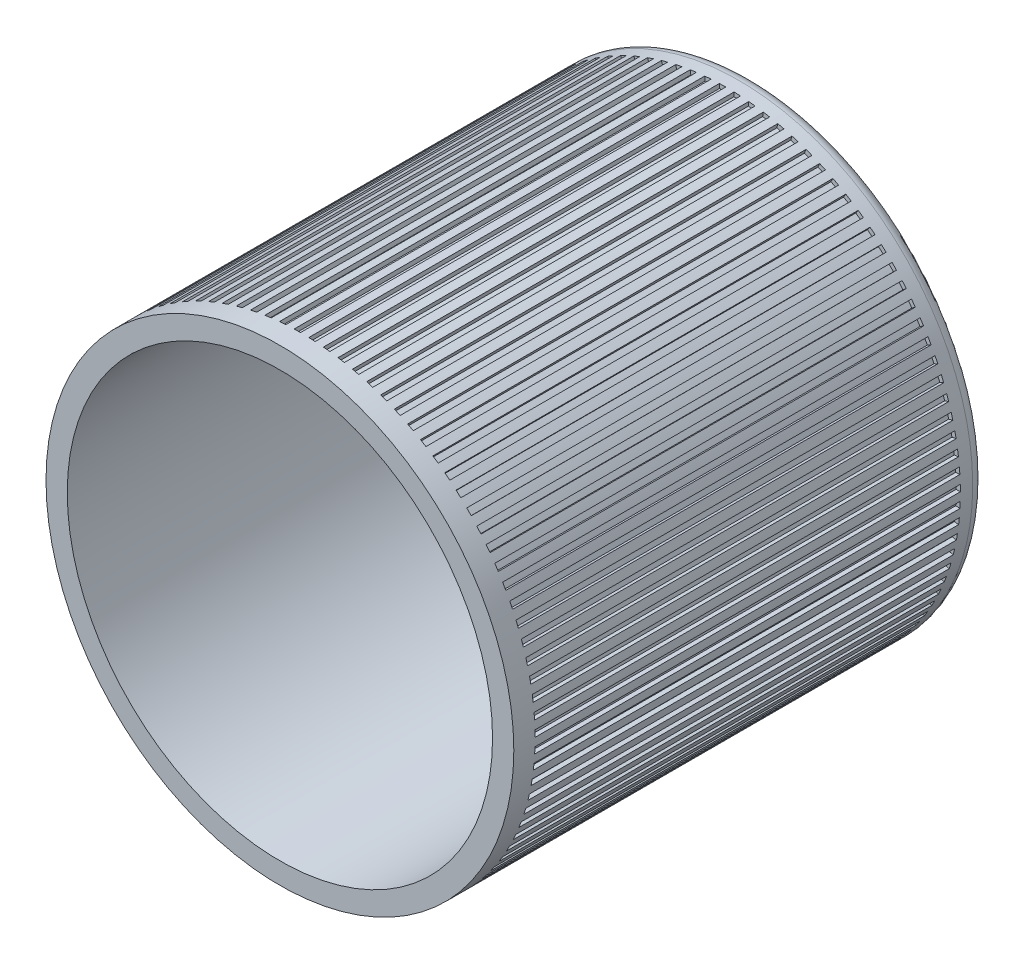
SolidWorks part; units mm, degrees
ref_plane "Front Plane" through (0, 0, 0) normal (0, 0, 1) x (1, 0, 0)
ref_plane "Top Plane" through (0, 0, 0) normal (0, 1, 0) x (1, 0, 0)
ref_plane "Right Plane" through (0, 0, 0) normal (1, 0, 0) x (0, 0, -1)
sketch "Sketch1" plane through (0, 0, 0) normal (0, 1, 0) x (1, 0, 0)
  line L0 (0, 0) -> (0, 12) construction
  line L1 (5.5, 0) -> (5, 0)
  line L2 (5.5, 0) -> (5.5, 11)
  line L4 (5, 0) -> (5, 10.6496)
  line L5 (0, 11.5) -> (0, 12)
  line L6 (5, 0.5) -> (5, 10.6496) construction
  line L7 (5.5, 0) -> (0, 0) construction
  line L8 (5, 0.5) -> (0, 0.5) construction
  arc A0 (5.5, 11) -> (0, 12) centre (0, -3.625) ccw
  arc A1 (5, 10.6496) -> (0, 11.5) centre (0, -3.625) ccw
  dimension "D1" = 5.5
  dimension "D3" = 15.625
  dimension "D5" = 0.5
  dimension "D2" = 11
  dimension "D4" = 12
revolve "Revolve1" add sketch "Sketch1" angle 360 about L0
fillet "Fillet1" radius 0.3 1 edges at (5.5, 0, -11)
sketch "Sketch2" plane through (0, 0, 0) normal (0, 1, 0) x (1, 0, 0)
  line L0 (3.2895, 10.5) -> (3.4395, 10.5)
  line L1 (3.4395, 10.5) -> (3.4395, 0.5)
  line L2 (3.2895, 0.5) -> (3.4395, 0.5)
  line L3 (3.2895, 10.5) -> (3.2895, 0.5)
  line L4 (-5.5, 10.5) -> (5.5, 10.5) construction
  line L5 (-5.5, 0.5) -> (5.5, 0.5) construction
  dimension "D1" = 10
  dimension "D2" = 0.15
wrap "Wrap1" sketch "Sketch2" wrap type deboss source sketch "Sketch2" thickness 0.1 parameters "D1"=0.1
pattern_circular "CirPattern1" count 100 over 360 about axis through (0, 0, 0) along (0, 0, 1) of "Wrap1"
